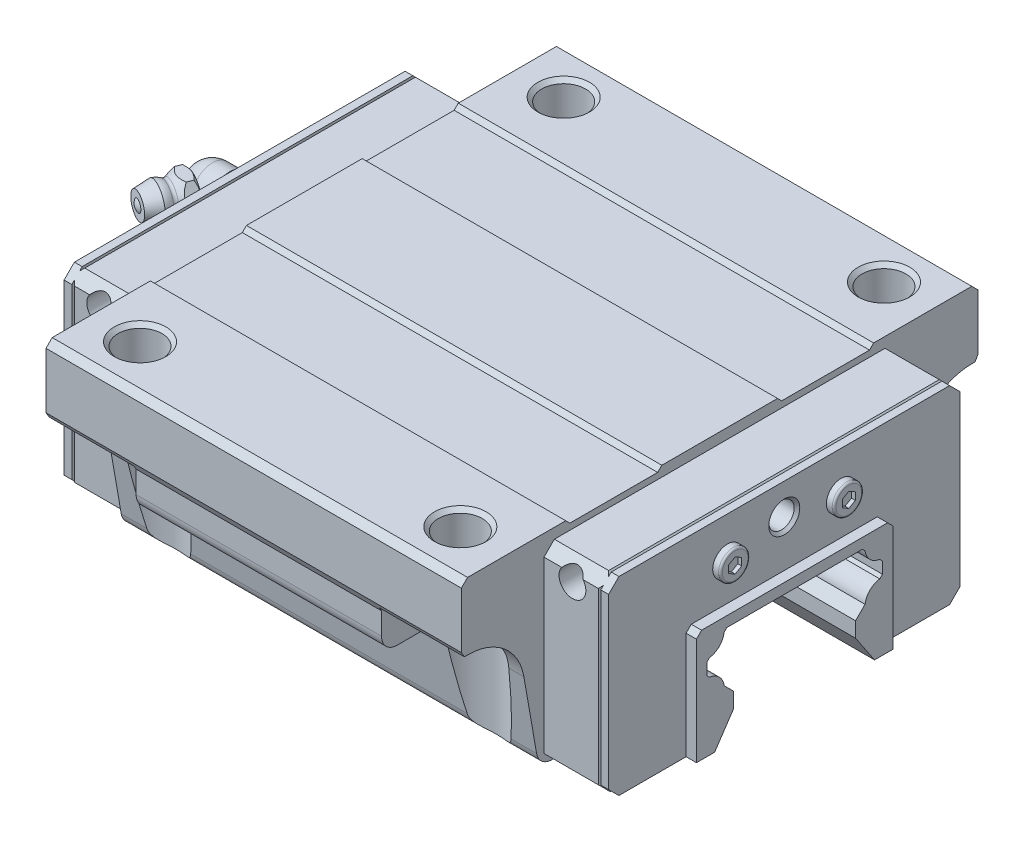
SolidWorks part; units mm, degrees
ref_plane "Front Plane" through (0, 0, 0) normal (0, 0, 1) x (1, 0, 0)
ref_plane "Top Plane" through (0, 0, 0) normal (0, 1, 0) x (1, 0, 0)
ref_plane "Right Plane" through (0, 0, 0) normal (1, 0, 0) x (0, 0, -1)
imported_body "HSR35C1SS-280L_G20_0_B-M6F_85-3_0_0_0_1.stp-1/_HSR35CSSB-M6F1 Slider-1.stp-1-solid1"
imported_body "HSR35C1SS-280L_G20_0_B-M6F_85-3_0_0_0_1.stp-1/_hsr_ftht_B-M6F_grease_nipple_joint.stp-1-solid1"
move or copy body "Body-Move/Copy1" bodies to move or copy 103 104 copy no translate (-120, 0, 0)
